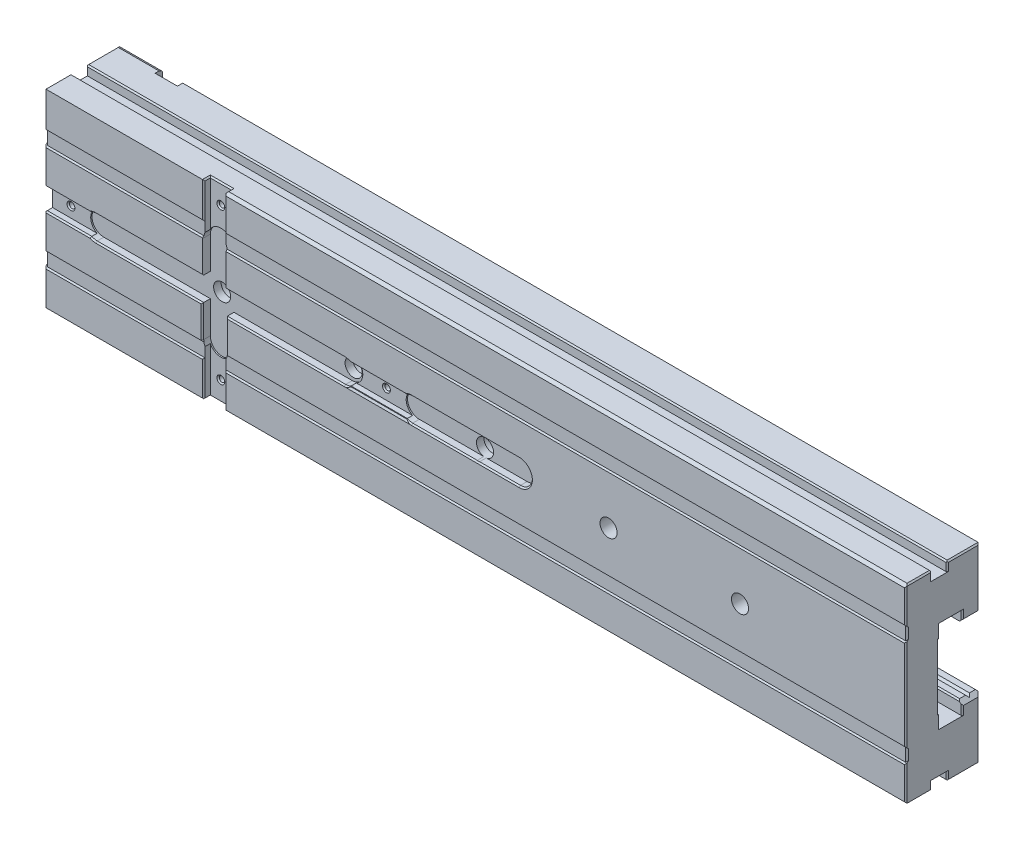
SolidWorks part; units mm, degrees
ref_plane "Front Plane" through (0, 0, 0) normal (0, 0, 1) x (1, 0, 0)
ref_plane "Top Plane" through (0, 0, 0) normal (0, 1, 0) x (1, 0, 0)
ref_plane "Right Plane" through (0, 0, 0) normal (1, 0, 0) x (0, 0, -1)
imported_body "Imported1"
sketch "Sketch1" plane through (0, 0, -24.2) normal (0, 0, -1) x (-1, 0, 0)
  circle A0 centre (248.5, 0) radius 10
  circle A1 centre (148.5, 0) radius 10
  circle A2 centre (48.5, 0) radius 10
extrude "Boss-Extrude1" add sketch "Sketch1" against normal up to surface (18.2 mm away)
sketch "Sketch2" plane through (0, 0, -24.2) normal (0, 0, -1) x (-1, 0, 0)
  circle A0 centre (-51.5, 0) radius 10
  circle A1 centre (-151.5, 0) radius 10
extrude "Boss-Extrude2" add sketch "Sketch2" against normal up to surface (24.2 mm away)
hole_wizard "Hole1" positions "Sketch4" profile "Sketch3" legacy
sketch "Sketch4" plane through (0, 0, -24.2) normal (0, 0, -1) x (-1, 0, 0)
  line L0 (377.5, 71.5) -> (377.5, 26.5) construction
  circle A2 centre (222.5, 0) radius 10 construction
  point P0 (248.5, 0)
  point P5 (148.5, 0)
  point P8 (48.5329, -2.5639)
  point P10 (-51.4671, -2.5672)
  point P12 (-151.4671, -2.5672)
  dimension "D6" = 0
  dimension "D1" = 129
  dimension "D2" = 100
  dimension "D3" = 100
  dimension "D4" = 100
  dimension "D5" = 100
sketch "Sketch3" plane through (-248.5, 0, -24.2) normal (1, 0, 0) x (0, 1, 0)
  line L0 (0, 0) -> (0, 100)
  line L1 (0, 100) -> (6.5, 100)
  line L2 (6.5, 100) -> (6.5, 12.5)
  line L3 (6.5, 12.5) -> (9.5, 12.5)
  line L4 (9.5, 12.5) -> (9.5, 0)
  line L5 (9.5, 0) -> (0, 0)
  line L6 (0, 110) -> (0, -10) construction
  dimension "Diameter" = 13
  dimension "Depth" = 100
  dimension "C-Bore Diameter" = 19
  dimension "C-Bore Depth" = 12.5
